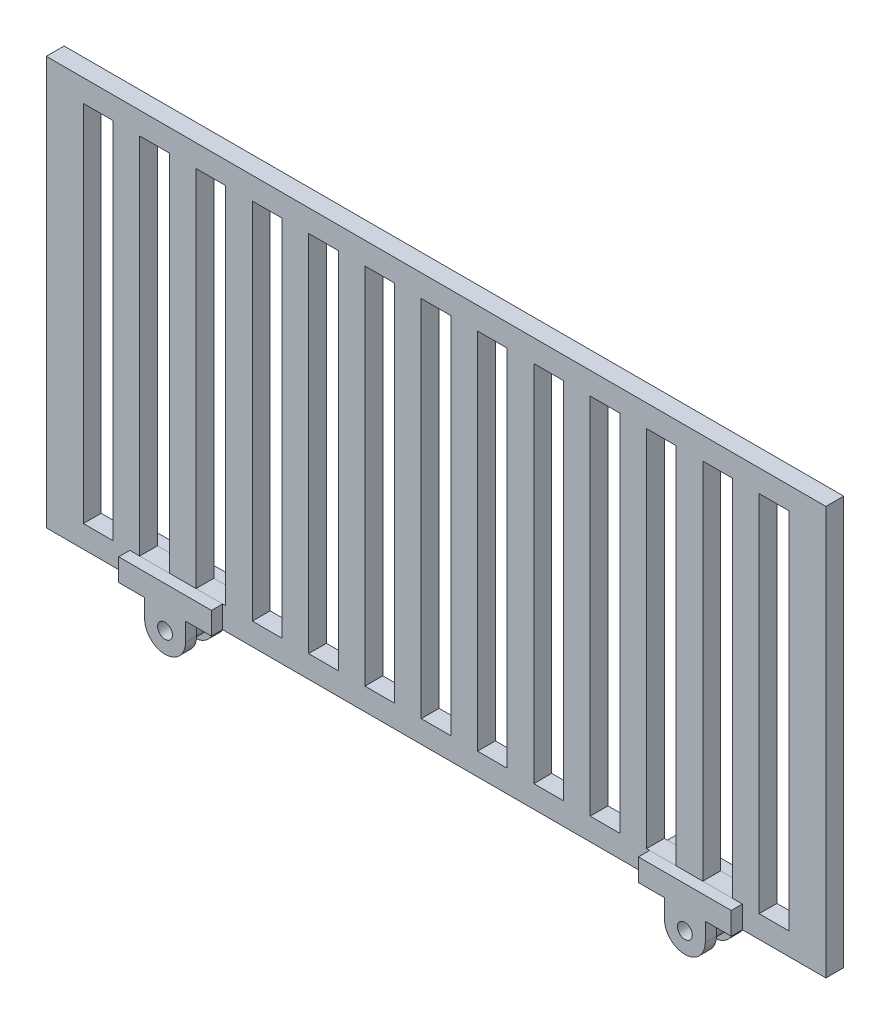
SolidWorks part; units mm, degrees
ref_plane "Front Plane" through (0, 0, 0) normal (0, 0, 1) x (1, 0, 0)
ref_plane "Top Plane" through (0, 0, 0) normal (0, 1, 0) x (1, 0, 0)
ref_plane "Right Plane" through (0, 0, 0) normal (1, 0, 0) x (0, 0, -1)
sketch "Sketch1" [suppressed] plane through (0, 0, 0) normal (0, 0, 1) x (1, 0, 0)
  circle A0 centre (0, 0) radius 14
  dimension "D1" = 28
extrude "Boss-Extrude1" [suppressed] add sketch "Sketch1" along normal blind 19
sketch "Sketch2" [suppressed] plane through (0, 0, 19) normal (0, 0, 1) x (1, 0, 0)
  line L1 (-7.2, -12.0067) -> (7.2, -12.0067)
  line L2 (-7.2, -12.0067) -> (-7.2, -17)
  line L3 (-7.2, -17) -> (7.2, -17)
  line L4 (7.2, -12.0067) -> (7.2, -17)
  circle A0 centre (0, 0) radius 14 construction
  dimension "D2" = 31
  dimension "D1" = 14.4
extrude "Boss-Extrude2" [suppressed] add sketch "Sketch2" against normal up to surface (19 mm away)
sketch "Sketch3" [suppressed] plane through (0, 0, 19) normal (0, 0, 1) x (1, 0, 0)
  line L0 (-17.5, 0) -> (17.5, 0) construction
  line L1 (-17.5, 3.5) -> (17.5, 3.5)
  line L2 (-17.5, -3.5) -> (17.5, -3.5)
  line L3 (0, -10.45) -> (0, 10.45) construction
  arc A0 (-17.5, 3.5) -> (-17.5, -3.5) centre (-17.5, 0) ccw
  arc A1 (17.5, -3.5) -> (17.5, 3.5) centre (17.5, 0) ccw
  circle A2 centre (-17.5, 0) radius 2.05
  circle A3 centre (17.5, 0) radius 2.05
  point P2 (0, 0)
  dimension "D2" = 42
  dimension "D3" = 4.1
  dimension "D1" = 7
extrude "Boss-Extrude3" [suppressed] add sketch "Sketch3" against normal blind 0.88
sketch "Sketch4" [suppressed] plane through (0, 0, 19) normal (0, 0, 1) x (1, 0, 0)
  line L1 (-7.2, -17) -> (7.2, -17) construction
  circle A0 centre (0, 7.75) radius 4.55
  dimension "D1" = 9.1
  dimension "D2" = 29.3
extrude "Boss-Extrude4" [suppressed] add sketch "Sketch4" along normal offset from surface (1.6 mm away) 20.6
sketch "Sketch5" [suppressed] plane through (0, 0, 20.6) normal (0, 0, 1) x (1, 0, 0)
  circle A0 centre (0, 7.75) radius 2.45
  dimension "D1" = 4.9
extrude "Boss-Extrude5" [suppressed] add sketch "Sketch5" along normal offset from surface (8 mm away) 28.6
sketch "Sketch6" [suppressed] plane through (0, 0, 28.6) normal (0, 0, 1) x (1, 0, 0)
  line L1 (-2.9751, 9.2) -> (2.9751, 9.2)
  line L2 (-2.9751, 9.2) -> (-2.9751, 6.3)
  line L3 (-2.9751, 6.3) -> (2.9751, 6.3)
  line L4 (2.9751, 9.2) -> (2.9751, 6.3)
  line L5 (-2.9751, 9.2) -> (2.9751, 6.3) construction
  line L6 (-2.9751, 6.3) -> (2.9751, 9.2) construction
  point P0 (0, 7.75)
  dimension "D1" = 2.9
extrude "Cut-Extrude1" [suppressed] cut sketch "Sketch6" against normal blind 6 flip side to cut
sketch "Sketch7" [suppressed] plane through (0, 0, 0) normal (0, 1, 0) x (1, 0, 0)
  line L1 (-300, 175) -> (300, 175)
  line L2 (-300, 175) -> (-300, -175)
  line L3 (-300, -175) -> (300, -175)
  line L4 (300, 175) -> (300, -175)
  line L5 (-300, 175) -> (300, -175) construction
  line L6 (-300, -175) -> (300, 175) construction
  point P0 (0, 0)
  dimension "D1" = 600
  dimension "D2" = 350
extrude "Boss-Extrude6" [suppressed] add sketch "Sketch7" along normal blind 18
sketch "Sketch8" [suppressed] plane through (0, 18, 0) normal (0, 1, 0) x (1, 0, 0)
  line L1 (-215, 15) -> (215, 15)
  line L2 (-215, 15) -> (-215, -15)
  line L3 (-215, -15) -> (215, -15)
  line L4 (215, 15) -> (215, -15)
  line L5 (-215, 15) -> (215, -15) construction
  line L6 (-215, -15) -> (215, 15) construction
  point P0 (0, 0)
  dimension "D1" = 30
  dimension "D2" = 430
extrude "Cut-Extrude2" [suppressed] cut sketch "Sketch8" against normal blind 10
sketch "Sketch9" [suppressed] plane through (0, 8, 0) normal (0, 1, 0) x (1, 0, 0)
  line L4 (215, -15) -> (215, 15)
  line L5 (215, 15) -> (-215, 15)
  line L6 (-215, 15) -> (-215, -15)
  line L7 (-215, -15) -> (215, -15)
  line L8 (215, -15) -> (215, 15)
  line L9 (215, 15) -> (-215, 15)
  line L10 (-215, 15) -> (-215, -15)
  line L11 (-215, -15) -> (215, -15)
  dimension "D1" = 0
extrude "Boss-Extrude7" [suppressed] add sketch "Sketch9" along normal blind 4.8 separate body
sketch "Sketch10" [suppressed] plane through (0, 12.8, 0) normal (0, 1, 0) x (1, 0, 0)
  line L0 (215, -15) -> (215, 15) construction
  line L1 (-215, 2.4) -> (215, 2.4)
  line L2 (-215, 2.4) -> (-215, -2.4)
  line L3 (-215, -2.4) -> (215, -2.4)
  line L4 (215, 2.4) -> (215, -2.4)
  line L5 (-215, 2.4) -> (215, -2.4) construction
  line L6 (-215, -2.4) -> (215, 2.4) construction
  point P0 (0, 0)
  dimension "D1" = 4.8
extrude "Boss-Extrude8" [suppressed] add sketch "Sketch10" along normal blind 5 separate body
sketch "Sketch11" [suppressed] plane through (0, 8, 0) normal (0, -1, 0) x (1, 0, 0)
  line L0 (-215, 2.4) -> (215, 2.4) construction
  line L1 (-181.9231, 2.4) -> (-148.8462, 2.4)
  line L2 (-181.9231, 2.4) -> (-181.9231, -2.4)
  line L3 (-181.9231, -2.4) -> (-148.8462, -2.4)
  line L4 (-148.8462, 2.4) -> (-148.8462, -2.4)
  line L5 (215, -2.4) -> (-215, -2.4) construction
  line L6 (0, -9.9) -> (0, 9.9) construction
  line L7 (-115.7692, 2.4) -> (-82.6923, 2.4)
  line L8 (-115.7692, 2.4) -> (-115.7692, -2.4)
  line L9 (-115.7692, -2.4) -> (-82.6923, -2.4)
  line L10 (-82.6923, 2.4) -> (-82.6923, -2.4)
  line L11 (-49.6154, 2.4) -> (-16.5385, 2.4)
  line L12 (-49.6154, 2.4) -> (-49.6154, -2.4)
  line L13 (-49.6154, -2.4) -> (-16.5385, -2.4)
  line L14 (-16.5385, 2.4) -> (-16.5385, -2.4)
  line L15 (16.5385, 2.4) -> (16.5385, -2.4)
  line L16 (49.6154, -2.4) -> (16.5385, -2.4)
  line L17 (49.6154, 2.4) -> (49.6154, -2.4)
  line L18 (49.6154, 2.4) -> (16.5385, 2.4)
  line L19 (82.6923, 2.4) -> (82.6923, -2.4)
  line L20 (115.7692, -2.4) -> (82.6923, -2.4)
  line L21 (115.7692, 2.4) -> (115.7692, -2.4)
  line L22 (115.7692, 2.4) -> (82.6923, 2.4)
  line L23 (148.8462, 2.4) -> (148.8462, -2.4)
  line L24 (181.9231, -2.4) -> (148.8462, -2.4)
  line L25 (181.9231, 2.4) -> (181.9231, -2.4)
  line L26 (181.9231, 2.4) -> (148.8462, 2.4)
  line L27 (-215, 2.4) -> (-181.9231, 2.4) construction
  line L28 (-148.8462, 2.4) -> (-115.7692, 2.4) construction
  line L29 (-82.6923, 2.4) -> (-49.6154, 2.4) construction
  line L30 (-16.5385, 2.4) -> (16.5385, 2.4) construction
extrude "Cut-Extrude3" [suppressed] cut sketch "Sketch11" against normal up to surface (4.8 mm away)
sketch "Sketch12" [suppressed] plane through (0, 12.8, 0) normal (0, -1, 0) x (1, 0, 0)
  line L4 (-16.5385, 2.4) -> (-49.6154, 2.4)
  line L5 (-16.5385, -2.4) -> (-16.5385, 2.4)
  line L6 (-49.6154, -2.4) -> (-16.5385, -2.4)
  line L7 (-49.6154, 2.4) -> (-49.6154, -2.4)
  line L8 (-16.5385, 2.4) -> (-49.6154, 2.4)
  line L9 (-16.5385, -2.4) -> (-16.5385, 2.4)
  line L10 (-49.6154, -2.4) -> (-16.5385, -2.4)
  line L11 (-49.6154, 2.4) -> (-49.6154, -2.4)
  line L12 (-82.6923, 2.4) -> (-115.7692, 2.4)
  line L13 (-82.6923, -2.4) -> (-82.6923, 2.4)
  line L14 (-115.7692, -2.4) -> (-82.6923, -2.4)
  line L15 (-115.7692, 2.4) -> (-115.7692, -2.4)
  line L16 (-82.6923, 2.4) -> (-115.7692, 2.4)
  line L17 (-82.6923, -2.4) -> (-82.6923, 2.4)
  line L18 (-115.7692, -2.4) -> (-82.6923, -2.4)
  line L19 (-115.7692, 2.4) -> (-115.7692, -2.4)
  line L20 (-148.8462, 2.4) -> (-181.9231, 2.4)
  line L21 (-148.8462, -2.4) -> (-148.8462, 2.4)
  line L22 (-181.9231, -2.4) -> (-148.8462, -2.4)
  line L23 (-181.9231, 2.4) -> (-181.9231, -2.4)
  line L24 (-148.8462, 2.4) -> (-181.9231, 2.4)
  line L25 (-148.8462, -2.4) -> (-148.8462, 2.4)
  line L26 (-181.9231, -2.4) -> (-148.8462, -2.4)
  line L27 (-181.9231, 2.4) -> (-181.9231, -2.4)
  line L28 (148.8462, 2.4) -> (148.8462, -2.4)
  line L29 (148.8462, -2.4) -> (181.9231, -2.4)
  line L30 (181.9231, -2.4) -> (181.9231, 2.4)
  line L31 (181.9231, 2.4) -> (148.8462, 2.4)
  line L32 (148.8462, 2.4) -> (148.8462, -2.4)
  line L33 (148.8462, -2.4) -> (181.9231, -2.4)
  line L34 (181.9231, -2.4) -> (181.9231, 2.4)
  line L35 (181.9231, 2.4) -> (148.8462, 2.4)
  line L36 (82.6923, 2.4) -> (82.6923, -2.4)
  line L37 (82.6923, -2.4) -> (115.7692, -2.4)
  line L38 (115.7692, -2.4) -> (115.7692, 2.4)
  line L39 (115.7692, 2.4) -> (82.6923, 2.4)
  line L40 (82.6923, 2.4) -> (82.6923, -2.4)
  line L41 (82.6923, -2.4) -> (115.7692, -2.4)
  line L42 (115.7692, -2.4) -> (115.7692, 2.4)
  line L43 (115.7692, 2.4) -> (82.6923, 2.4)
  line L44 (16.5385, 2.4) -> (16.5385, -2.4)
  line L45 (16.5385, -2.4) -> (49.6154, -2.4)
  line L46 (49.6154, -2.4) -> (49.6154, 2.4)
  line L47 (49.6154, 2.4) -> (16.5385, 2.4)
  line L48 (16.5385, 2.4) -> (16.5385, -2.4)
  line L49 (16.5385, -2.4) -> (49.6154, -2.4)
  line L50 (49.6154, -2.4) -> (49.6154, 2.4)
  line L51 (49.6154, 2.4) -> (16.5385, 2.4)
  dimension "D1" = 0
  dimension "D2" = 0
  dimension "D3" = 0
  dimension "D4" = 0
  dimension "D5" = 0
  dimension "D6" = 0
extrude "Boss-Extrude9" [suppressed] add sketch "Sketch12" along normal up to surface (4.8 mm away)
sketch "Sketch13" plane through (0, 0, 0) normal (0, 0, 1) x (1, 0, 0)
  line L1 (-105, 55) -> (105, 55)
  line L2 (-105, 55) -> (-105, -55)
  line L3 (-105, -55) -> (105, -55)
  line L4 (105, 55) -> (105, -55)
  line L5 (-105, 55) -> (105, -55) construction
  line L6 (-105, -55) -> (105, 55) construction
  point P0 (0, 0)
  dimension "D1" = 210
  dimension "D2" = 110
extrude "Boss-Extrude10" add sketch "Sketch13" along normal mid plane 4.8
sketch "Sketch14" plane through (0, 0, 2.4) normal (0, 0, 1) x (1, 0, 0)
  line L0 (-105, -55) -> (105, -55) construction
  line L1 (-95, 49) -> (-87, 49)
  line L2 (-95, 49) -> (-95, -49)
  line L3 (-95, -49) -> (-87, -49)
  line L4 (-87, 49) -> (-87, -49)
  line L5 (-105, 55) -> (-105, -55) construction
  point P4 (-87, 0)
  dimension "D1" = 8
  dimension "D2" = 6
  dimension "D3" = 10
extrude "Cut-Extrude4" cut sketch "Sketch14" against normal up to surface (4.8 mm away)
pattern_linear "LPattern1" count 13 spacing 15.1667 along (1, 0, 0) of "Cut-Extrude4"
sketch "Sketch15" plane through (0, 0, 2.4) normal (0, 0, 1) x (1, 0, 0)
  line L0 (0, -86.9) -> (0, 86.9) construction
  line L1 (-105, -55) -> (105, -55) construction
  line L2 (-105, 55) -> (-105, -55) construction
  circle A0 centre (-70, -60) radius 4
  circle A1 centre (70, -60) radius 4
  circle A2 centre (-70, -60) radius 2
  circle A3 centre (70, -60) radius 2
  dimension "D1" = 8
  dimension "D4" = 4
  dimension "D2" = 1
  dimension "D3" = 35
extrude "Boss-Extrude11" add sketch "Sketch15" against normal up to surface (4.8 mm away) separate body
sketch "Sketch16" plane through (0, 0, 2.4) normal (0, 0, 1) x (1, 0, 0)
  line L0 (-75.5, -60) -> (-75.5, -55)
  line L12 (-105, -55) -> (105, -55) construction
  line L13 (-75.5, -55) -> (-82.5, -55)
  line L14 (-82.5, -55) -> (-82.5, -49)
  line L15 (-82.5, -49) -> (-57.5, -49)
  line L16 (-70, -60) -> (-70, -51.6778) construction
  line L17 (-57.5, -55) -> (-57.5, -49)
  line L18 (-64.5, -55) -> (-57.5, -55)
  line L19 (-64.5, -60) -> (-64.5, -55)
  line L20 (-79.8333, -49) -> (-71.8333, -49) construction
  arc A3 (-75.5, -60) -> (-64.5, -60) centre (-70, -60) ccw
  circle A4 centre (-70, -60) radius 4 construction
  circle A5 centre (-70, -60) radius 2 construction
  circle A6 centre (-70, -60) radius 2
  arc A7 (-70, -54.5) -> (-75.5, -60) centre (-70, -60) ccw construction
  arc A8 (-64.5, -60) -> (-70, -54.5) centre (-70, -60) ccw construction
  dimension "D1" = 1.5
  dimension "D2" = 25
extrude "Boss-Extrude12" add sketch "Sketch16" along normal blind 3 separate body
mirror "Mirror1" about plane through (0, 0, 0) normal (0, 0, 1)
mirror "Mirror2" about plane through (0, 0, 0) normal (1, 0, 0)
sketch "Sketch17" [suppressed] plane through (0, 18, 0) normal (0, 1, 0) x (1, 0, 0)
  line L7 (-9, 50) -> (9, 50)
  line L8 (-9, 50) -> (-9, -50)
  line L9 (-9, -50) -> (9, -50)
  line L10 (9, 50) -> (9, -50)
  line L11 (-9, 50) -> (9, -50) construction
  line L12 (-9, -50) -> (9, 50) construction
  point P0 (0, 0)
  dimension "D1" = 18
  dimension "D2" = 100
extrude "Boss-Extrude13" [suppressed] add sketch "Sketch17" along normal blind 140 separate body
sketch "Sketch18" [suppressed] plane through (9, 0, 0) normal (1, 0, 0) x (0, 0, -1)
  line L0 (-50, 18) -> (50, 18) construction
  line L1 (-7.5, 148) -> (7.5, 148)
  line L2 (-7.5, 148) -> (-7.5, 18)
  line L3 (-7.5, 18) -> (7.5, 18)
  line L4 (7.5, 148) -> (7.5, 18)
  line L5 (-50, 158) -> (50, 158) construction
  point P8 (0, 158)
  point P9 (0, 148)
  dimension "D1" = 15
  dimension "D2" = 130
extrude "Cut-Extrude6" [suppressed] cut sketch "Sketch18" against normal up to surface (18 mm away)
sketch "Sketch19" [suppressed] plane through (-9, 0, 0) normal (-1, 0, 0) x (0, 0, 1)
  line L0 (7.5, 18) -> (7.5, 148) construction
  line L1 (50, 18) -> (7.5, 18)
  line L2 (50, 18) -> (50, 130)
  line L3 (50, 130) -> (7.5, 130)
  line L4 (7.5, 18) -> (7.5, 130)
  line L5 (7.5, 148) -> (-7.5, 148) construction
  dimension "D1" = 18
extrude "Cut-Extrude7" [suppressed] cut sketch "Sketch19" against normal up to surface (18 mm away)
sketch "Sketch20" [suppressed] plane through (-9, 0, 0) normal (-1, 0, 0) x (0, 0, 1)
  line L0 (50, 130) -> (7.5, 130) construction
  line L1 (22.5, 130) -> (50, 130)
  line L2 (22.5, 130) -> (22.5, 158)
  line L3 (22.5, 158) -> (50, 158)
  line L4 (50, 130) -> (50, 158)
  line L5 (7.5, 130) -> (7.5, 148) construction
  dimension "D1" = 15
extrude "Cut-Extrude8" [suppressed] cut sketch "Sketch20" against normal up to surface (18 mm away)
sketch "Sketch22" [suppressed] plane through (0, 0, 18.12) normal (0, 0, -1) x (-1, 0, 0)
  line L1 (-26, 16.5) -> (26, 16.5)
  line L2 (-26, 16.5) -> (-26, -25)
  line L3 (-26, -25) -> (26, -25)
  line L4 (26, 16.5) -> (26, -25)
  line L10 (-7.38, -12.1082) -> (-7.38, -17.18)
  line L11 (-7.38, -17.18) -> (7.38, -17.18)
  line L12 (7.38, -17.18) -> (7.38, -12.1082)
  line L13 (-7.38, -12.1082) -> (-7.38, -17.18)
  line L14 (-7.38, -17.18) -> (7.38, -17.18)
  line L15 (7.38, -17.18) -> (7.38, -12.1082)
  arc A0 (-17.5, 3.5) -> (-17.5, -3.5) centre (-17.5, 0) ccw construction
  arc A1 (7.2, -12.0067) -> (-7.2, -12.0067) centre (0, 0) ccw construction
  arc A4 (7.38, -12.1082) -> (-7.38, -12.1082) centre (0, 0) ccw
  arc A5 (7.38, -12.1082) -> (-7.38, -12.1082) centre (0, 0) ccw
  point P4 (0, 16.5)
  dimension "D1" = 5
  dimension "D2" = 2.5
  dimension "D3" = 25
  dimension "D4" = 0.18
extrude "Boss-Extrude14" [suppressed] add sketch "Sketch22" along normal blind 4.8 separate body
sketch "Sketch23" [suppressed] plane through (0, 0, 13.32) normal (0, 0, -1) x (-1, 0, 0)
  line L0 (0, 15.73) -> (0, -15.73) construction
  circle A0 centre (-17.5, 0) radius 2
  circle A1 centre (17.5, 0) radius 2
  dimension "D1" = 4
extrude "Cut-Extrude9" [suppressed] cut sketch "Sketch23" against normal through all
sketch "Sketch24" [suppressed] plane through (26, 0, 0) normal (1, 0, 0) x (0, 0, -1)
  line L0 (-13.32, -25) -> (11.68, -25)
  line L1 (11.68, -25) -> (11.68, -5)
  line L2 (11.68, -5) -> (1.68, 16.5)
  line L3 (1.68, 16.5) -> (-13.32, 16.5)
  line L4 (-13.32, 16.5) -> (-13.32, -25)
  dimension "D1" = 15
  dimension "D2" = 25
  dimension "D3" = 20
extrude "Boss-Extrude15" [suppressed] add sketch "Sketch24" against normal blind 4.8 separate body
mirror "Mirror3" [suppressed] about plane through (0, 0, 0) normal (1, 0, 0)
sketch "Sketch26" [suppressed] plane through (0, -25, 0) normal (0, -1, 0) x (1, 0, 0)
  line L0 (26, 18.12) -> (-26, 18.12) construction
  line L1 (-30, 21.12) -> (30, 21.12)
  line L2 (-30, 21.12) -> (-30, -13.88)
  line L3 (-30, -13.88) -> (30, -13.88)
  line L4 (30, 21.12) -> (30, -13.88)
  point P4 (0, -13.88)
  dimension "D1" = 3
  dimension "D2" = 60
  dimension "D3" = 35
extrude "Boss-Extrude16" [suppressed] add sketch "Sketch26" along normal blind 4.8 separate body
sketch "Sketch27" [suppressed] plane through (0, -25, 0) normal (0, 1, 0) x (1, 0, 0)
  line L0 (0, -23.364) -> (0, 23.364) construction
  line L1 (-30, 13.88) -> (30, 13.88) construction
  line L2 (-26, -13.32) -> (26, -13.32) construction
  circle A0 centre (17.5, -8.32) radius 2
  circle A1 centre (0, 8.88) radius 2
  circle A2 centre (-17.5, -8.32) radius 2
  dimension "D1" = 4
  dimension "D2" = 35
  dimension "D3" = 5
  dimension "D4" = 5
extrude "Cut-Extrude10" [suppressed] cut sketch "Sketch27" against normal up to surface (4.8 mm away)
sketch "Sketch28" [suppressed] plane through (0, 0, 18.12) normal (0, 0, 1) x (1, 0, 0)
  line L0 (7.38, -17.18) -> (-7.38, -17.18) construction
  line L1 (-3, -17.18) -> (3, -17.18)
  line L2 (-3, -17.18) -> (-3, -20.18)
  line L3 (-3, -20.18) -> (3, -20.18)
  line L4 (3, -17.18) -> (3, -20.18)
  point P6 (0, -20.18)
  dimension "D1" = 6
  dimension "D2" = 3
extrude "Cut-Extrude11" [suppressed] cut sketch "Sketch28" against normal up to surface (4.8 mm away)
